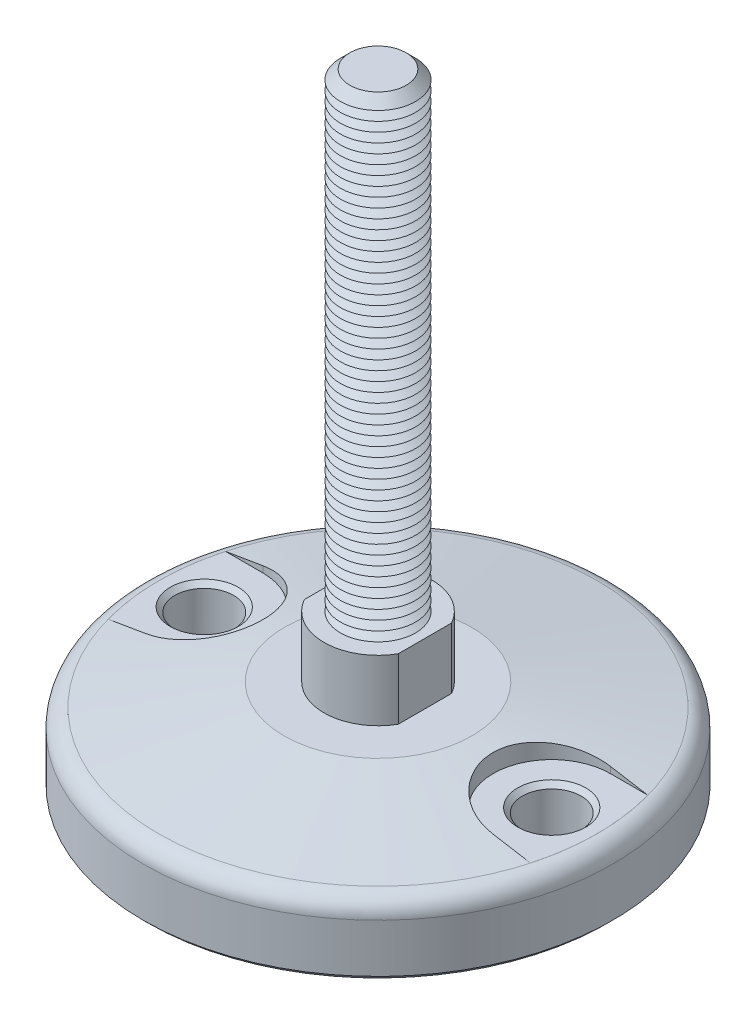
SolidWorks part; units mm, degrees
ref_plane "Front Plane" through (0, 0, 0) normal (0, 0, 1) x (1, 0, 0)
ref_plane "Top Plane" through (0, 0, 0) normal (0, 1, 0) x (1, 0, 0)
ref_plane "Right Plane" through (0, 0, 0) normal (1, 0, 0) x (0, 0, -1)
sketch "Sketch1" plane through (0, 0, 0) normal (1, 0, 0) x (0, 0, -1)
  line L0 (0, 61.3389) -> (0, -58.404) construction
sketch "Sketch2" plane through (0, 0, 0) normal (1, 0, 0) x (0, 0, -1)
  line L0 (0, 0) -> (-20, 0)
  line L1 (-20, 0) -> (-50, -5.2898)
  line L2 (-50, -5.2898) -> (-50, -20)
  line L3 (-50, -20) -> (0, -20)
  line L4 (0, 61.3389) -> (0, -58.404) construction
  line L5 (0, -20) -> (0, 0)
  dimension "D1" = 20
  dimension "D2" = 50
  dimension "D3" = 20
  dimension "D4" = 10
revolve "Revolve1" add sketch "Sketch2" angle 360 about L0
fillet "Fillet1" radius 4 1 edges at (0, -5.2898, 50)
sketch "Sketch3" plane through (0, 0, 0) normal (0, 1, 0) x (1, 0, 0)
  circle A0 centre (0, 0) radius 11.5
  dimension "D1" = 23
extrude "Boss-Extrude1" add sketch "Sketch3" along normal blind 13
sketch "Sketch4" plane through (0, 13, 0) normal (0, 1, 0) x (1, 0, 0)
  line L0 (-10, 5.6789) -> (-10, -5.6789)
  line L2 (10, -5.6789) -> (10, 5.6789)
  arc A0 (-10, 5.6789) -> (-10, -5.6789) centre (0, 0) ccw
  circle A1 centre (0, 0) radius 11.5 construction
  arc A2 (10, -5.6789) -> (10, 5.6789) centre (0, 0) ccw
  dimension "D1" = 20
extrude "Cut-Extrude1" cut sketch "Sketch4" against normal blind 13
sketch "Sketch5" plane through (0, 13, 0) normal (0, 1, 0) x (1, 0, 0)
  circle A0 centre (0, 0) radius 8
  dimension "D1" = 16
extrude "Boss-Extrude2" add sketch "Sketch5" along normal blind 100
chamfer "Chamfer1" distance 2 angle 45 1 edges at (0, 113, 8)
sketch "Sketch6" plane through (0, 0, 0) normal (1, 0, 0) x (0, 0, -1)
  line L0 (-8, 13) -> (-6.2679, 14)
  line L1 (-6.2679, 14) -> (-8, 15)
  line L2 (-8, 111) -> (-8, 13) construction
  line L3 (-8, 15) -> (-8, 13)
  dimension "D1" = 2
revolve "Cut-Revolve1" cut sketch "Sketch6" angle 360 about L0
pattern_linear "LPattern1" count 49 spacing 2 along (0, 1, 0) of "Cut-Revolve1"
sketch "Sketch8" plane through (0, 0, 0) normal (0, 1, 0) x (1, 0, 0)
  line L0 (-37, 12.5) -> (-44.9904, 12.5)
  line L1 (-37, -12.5) -> (-44.9904, -12.5)
  arc A1 (-44.9904, 12.5) -> (-44.9904, -12.5) centre (0, 0) ccw
  circle A2 centre (0, 0) radius 46.6946 construction
  arc A3 (-37, -12.5) -> (-37, 12.5) centre (-37, 0) ccw
  point P3 (-37, 0)
  point P11 (0, 0)
  dimension "D1" = 37
  dimension "D2" = 25
extrude "Cut-Extrude4" cut sketch "Sketch8" against normal blind 4.7
sketch "Sketch10" plane through (0, -4.7, 0) normal (0, 1, 0) x (1, 0, 0)
  circle A0 centre (-37, 0) radius 6.25
  dimension "D1" = 12.5
extrude "Cut-Extrude5" cut sketch "Sketch10" against normal up to surface (15.3 mm away)
chamfer "Chamfer2" distance 1 angle 45 2 edges at (-37, -20, -6.25) (-37, -4.7, 6.25)
mirror "Mirror1" about plane through (0, 0, 0) normal (1, 0, 0) of "Chamfer2", "Cut-Extrude5", "Cut-Extrude4"
chamfer "Chamfer3" distance 1 angle 45 1 edges at (0, -20, 50)
